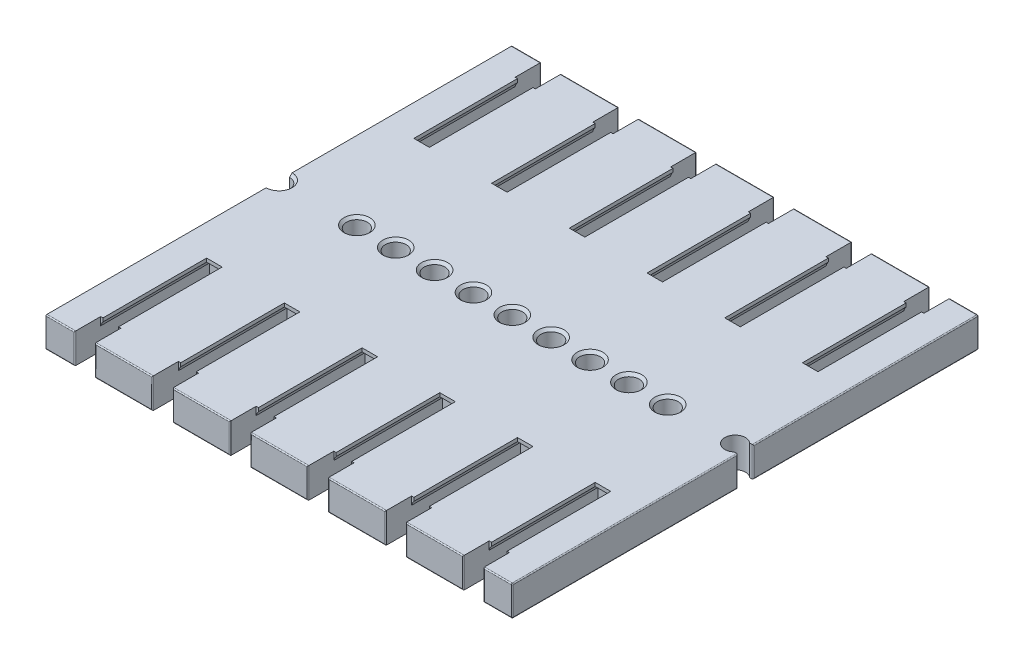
SolidWorks part; units mm, degrees
ref_plane "前视基准面" through (0, 0, 0) normal (0, 0, 1) x (1, 0, 0)
ref_plane "上视基准面" through (0, 0, 0) normal (0, 1, 0) x (1, 0, 0)
ref_plane "右视基准面" through (0, 0, 0) normal (1, 0, 0) x (0, 0, -1)
sketch "草图1" plane through (0, 0, 0) normal (0, 1, 0) x (1, 0, 0)
  line L0 (90, 45) -> (90, -45)
  line L1 (90, 45) -> (-90, 45)
  line L2 (90, -45) -> (-90, -45)
  line L3 (-90, 45) -> (-90, -45)
  line L4 (90, 45) -> (-90, -45) construction
  line L5 (90, -45) -> (-90, 45) construction
  point P1 (0, 0)
  dimension "D1" = 90
  dimension "D2" = 180
extrude "凸台-拉伸1" add sketch "草图1" along normal blind 5.8
sketch "草图2" plane through (0, 0, 45) normal (0, 0, 1) x (1, 0, 0)
  line L0 (-90, 2.9) -> (-82.5, 2.9) construction
  line L1 (-90, 5.8) -> (-90, 0) construction
  line L2 (-82.5, 2.9) -> (-82.5, 5.8) construction
  line L3 (-90, 5.8) -> (90, 5.8) construction
  line L4 (-82.5, 5.8) -> (-82.5, 3.8) construction
  line L5 (-81, 5.8) -> (-84, 5.8)
  line L6 (-84, 5.8) -> (-84, 5.1229)
  line L7 (-82.5, 2.9) -> (-80.55, 2.9) construction
  line L8 (-80.55, 1.5556) -> (-80.55, 4.2444)
  line L9 (-81, 5.8) -> (-81, 5.1229)
  line L10 (-81, 0) -> (-81, 0.6771)
  line L11 (-81, 0) -> (-84, 0)
  line L12 (-84, 0) -> (-84, 0.6771)
  line L13 (-84.45, 1.5556) -> (-84.45, 4.2444)
  arc A0 (-84, 5.1229) -> (-84.45, 4.2444) centre (-82.5, 3.8) ccw
  arc A1 (-80.55, 1.5556) -> (-81, 0.6771) centre (-82.5, 2) cw
  arc A2 (-80.55, 4.2444) -> (-81, 5.1229) centre (-82.5, 3.8) ccw
  arc A3 (-84, 0.6771) -> (-84.45, 1.5556) centre (-82.5, 2) cw
  dimension "D4" = 2
  dimension "D1" = 7.5
  dimension "D2" = 2
  dimension "D3" = 1.5
  dimension "D5" = 1.95
extrude "切除-拉伸1" cut sketch "草图2" against normal blind 26
sketch "草图3" plane through (0, 0, 19) normal (0, 0, 1) x (1, 0, 0)
  line L0 (-84, 5.8) -> (-84, 5.1229)
  line L1 (-84, 5.1229) -> (-81, 5.1229)
  line L2 (-81, 5.1229) -> (-81, 5.8)
  line L3 (-81, 5.8) -> (-84, 5.8)
  line L4 (-84, 0.6771) -> (-84, 0)
  line L5 (-84, 0) -> (-81, 0)
  line L6 (-81, 0) -> (-81, 0.6771)
  line L7 (-81, 0.6771) -> (-84, 0.6771)
extrude "凸台-拉伸2" add sketch "草图3" along normal blind 1
sketch "草图4" plane through (0, 0, 45) normal (0, 0, 1) x (1, 0, 0)
  line L0 (-90, 2.9) -> (-82.5, 2.9) construction
  line L1 (-90, 5.8) -> (-90, 0) construction
  line L2 (-80.55, 5.8) -> (-80.55, 0)
  line L3 (-80.55, 5.8) -> (-84.45, 5.8)
  line L4 (-80.55, 0) -> (-84.45, 0)
  line L5 (-84.45, 5.8) -> (-84.45, 0)
  line L6 (-80.55, 5.8) -> (-84.45, 0) construction
  line L7 (-80.55, 0) -> (-84.45, 5.8) construction
  dimension "D1" = 7.5
  dimension "D2" = 3.9
  dimension "D3" = 5.8
extrude "切除-拉伸2" cut sketch "草图4" against normal blind 5
mirror "镜向4" about plane through (0, 0, 0) normal (0, 0, 1) of "切除-拉伸2", "凸台-拉伸2", "切除-拉伸1"
pattern_linear "阵列(线性)4" count 12 spacing 15 along (1, 0, 0) of "镜向4", "切除-拉伸1", "凸台-拉伸2", "切除-拉伸2"
sketch "草图6" plane through (0, 0, 0) normal (0, -1, 0) x (1, 0, 0)
  line L0 (-90, 0) -> (-75, 0) construction
  line L1 (-90, -45) -> (-90, 45) construction
  circle A0 centre (-75, 0) radius 2
  dimension "D3" = 4
  dimension "D1" = 15
extrude "切除-拉伸3" cut sketch "草图6" against normal up to next
chamfer "倒角1" distance 0.5 angle 45 2 edges at (-75, 5.8, 2) (-75, 0, -2)
pattern_linear "阵列(线性)5" count 11 spacing 15 along (1, 0, 0) of "切除-拉伸3", "倒角1"
sketch "草图7" plane through (0, 0, 0) normal (0, -1, 0) x (1, 0, 0)
  line L0 (-90, 0) -> (-67.5, 0) construction
  line L1 (-90, -45) -> (-90, 45) construction
  circle A0 centre (-67.5, 0) radius 2
  dimension "D2" = 4
  dimension "D1" = 22.5
extrude "切除-拉伸4" cut sketch "草图7" against normal up to next
chamfer "倒角2" distance 0.5 angle 45 2 edges at (-67.5, 5.8, 2) (-67.5, 0, -2)
pattern_linear "阵列(线性)7" count 4 spacing 15 along (1, 0, 0) of "倒角2", "切除-拉伸4"
mirror "镜向5" about plane through (0, 0, 0) normal (1, 0, 0) of "阵列(线性)7", "切除-拉伸4", "倒角2"
sketch "草图8" plane through (0, 0, 0) normal (0, -1, 0) x (1, 0, 0)
  line L0 (-90, 0) -> (-88, 0) construction
  line L1 (-90, -45) -> (-90, 45) construction
  line L2 (-90, -1.5) -> (-90, 1.5)
  line L3 (-90, 1.5) -> (-89.3229, 1.5)
  line L4 (-90, -1.5) -> (-89.3229, -1.5)
  arc A0 (-89.3229, -1.5) -> (-89.3229, 1.5) centre (-88, 0) ccw
  dimension "D3" = 2
  dimension "D1" = 2
  dimension "D2" = 1.5
extrude "切除-拉伸5" cut sketch "草图8" against normal up to next
mirror "镜向6" about plane through (0, 0, 0) normal (1, 0, 0) of "切除-拉伸5"
fillet "圆角4" radius 0.2 116 edges at (-87.225, 5.8, 45) (-84.45, 2.9, 45) (-87.225, 0, 45) (-80.55, 2.9, 45) (-75, 5.8, 45) (-54.45, 2.9, 45) (-65.55, 2.9, 45) (-39.45, 2.9, 45) (-50.55, 2.9, 45) (-24.45, 2.9, 45) (-35.55, 2.9, 45) (-9.45, 2.9, 45) (-20.55, 2.9, 45) (5.55, 2.9, 45) (-5.55, 2.9, 45) (20.55, 2.9, 45) (9.45, 2.9, 45) (35.55, 2.9, 45) (24.45, 2.9, 45) (50.55, 2.9, 45) (39.45, 2.9, 45) (65.55, 2.9, 45) (54.45, 2.9, 45) (80.55, 2.9, 45) (69.45, 2.9, 45) (84.45, 2.9, 45) (90, 2.9, 45) (-69.45, 2.9, 45) (-90, 2.9, 45) (-75, 0, 45) (-60, 5.8, 45) (-45, 5.8, 45) (-30, 5.8, 45) (-15, 5.8, 45) (0, 5.8, 45) (15, 5.8, 45) (30, 5.8, 45) (45, 5.8, 45) (60, 5.8, 45) (75, 5.8, 45) (87.225, 5.8, 45) (87.225, 0, 45) (75, 0, 45) (60, 0, 45) (45, 0, 45) (30, 0, 45) (15, 0, 45) (0, 0, 45) (-15, 0, 45) (-30, 0, 45) (-45, 0, 45) (-60, 0, 45) (90, 0, 23.25) (90, 5.8, 23.25) (90, 2.9, 1.5) (90, 5.8, -23.25) (90, 0, -23.25) (90, 2.9, -1.5) (87.225, 0, -45) (90, 2.9, -45) (87.225, 5.8, -45) (84.45, 2.9, -45) (75, 5.8, -45) (69.45, 2.9, -45) (75, 0, -45) (80.55, 2.9, -45) (60, 5.8, -45) (54.45, 2.9, -45) (60, 0, -45) (65.55, 2.9, -45) (45, 5.8, -45) (35.55, 2.9, -45) (24.45, 2.9, -45) (50.55, 2.9, -45) (39.45, 2.9, -45) (-84.45, 2.9, -45) (-90, 2.9, -45) (-69.45, 2.9, -45) (-80.55, 2.9, -45) (-54.45, 2.9, -45) (-65.55, 2.9, -45) (-39.45, 2.9, -45) (-50.55, 2.9, -45) (-24.45, 2.9, -45) (-35.55, 2.9, -45) (-9.45, 2.9, -45) (-20.55, 2.9, -45) (5.55, 2.9, -45) (-5.55, 2.9, -45) (20.55, 2.9, -45) (9.45, 2.9, -45) (45, 0, -45) (30, 5.8, -45) (30, 0, -45) (15, 5.8, -45) (15, 0, -45) (0, 5.8, -45) (0, 0, -45) (-15, 5.8, -45) (-30, 5.8, -45) (-45, 5.8, -45) (-60, 5.8, -45) (-75, 5.8, -45) (-87.225, 5.8, -45) (-87.225, 0, -45) (-75, 0, -45) (-60, 0, -45) (-45, 0, -45) (-30, 0, -45) (-15, 0, -45) (-90, 5.8, -23.25) (-90, 2.9, -1.5) (-90, 0, -23.25) (-90, 0, 23.25) (-90, 2.9, 1.5) (-90, 5.8, 23.25)
sketch "草图9" plane through (0, 5.8, 0) normal (0, 1, 0) x (1, 0, 0)
  line L2 (-94.1582, 49.1736) -> (0, 49.1736)
  line L3 (-94.1582, 49.1736) -> (-94.1582, -49.5378)
  line L4 (-94.1582, -49.5378) -> (0, -49.5378)
  line L5 (0, 49.1736) -> (0, -49.5378)
extrude "切除-拉伸7" cut sketch "草图9" against normal up to next
